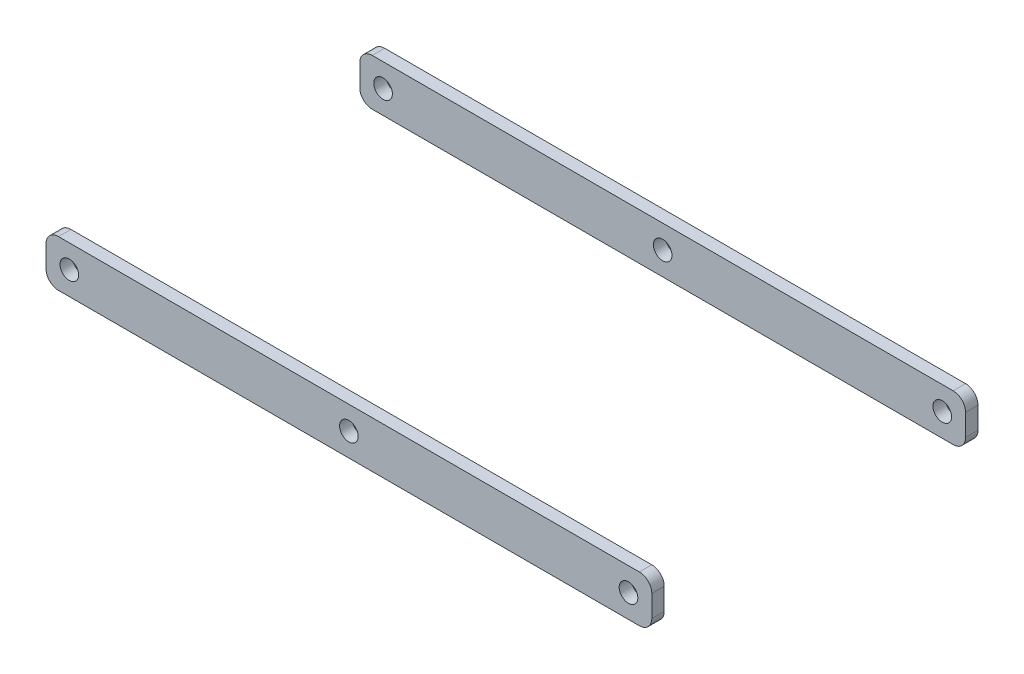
SolidWorks part; units mm, degrees
ref_plane "前视基准面" through (0, 0, 0) normal (0, 0, 1) x (1, 0, 0)
ref_plane "上视基准面" through (0, 0, 0) normal (0, 1, 0) x (1, 0, 0)
ref_plane "右视基准面" through (0, 0, 0) normal (1, 0, 0) x (0, 0, -1)
other "Configuration Table"
sketch "草图1" plane through (0, 0, 0) normal (0, 0, 1) x (1, 0, 0)
  line L1 (-195, -15) -> (195, -15)
  line L2 (-195, -15) -> (-195, 15)
  line L3 (-195, 15) -> (195, 15)
  line L4 (195, -15) -> (195, 15)
  line L5 (-195, -15) -> (195, 15) construction
  line L6 (-195, 15) -> (195, -15) construction
  point P0 (0, 0)
  dimension "D1" = 195
  dimension "D2" = 15
extrude "ArmBlank_390x30" add sketch "草图1" against normal mid plane 210
sketch "草图2" plane through (0, 0, 0) normal (0, 0, 1) x (1, 0, 0)
  line L1 (-200, -20) -> (200, -20)
  line L2 (-200, -20) -> (-200, 20)
  line L3 (-200, 20) -> (200, 20)
  line L4 (200, -20) -> (200, 20)
  line L5 (-200, -20) -> (200, 20) construction
  line L6 (-200, 20) -> (200, -20) construction
  point P0 (0, 0)
  dimension "D1" = 200
  dimension "D2" = 20
extrude "Separate_Left_Right_8mm_Arms" cut sketch "草图2" against normal mid plane 194
sketch "草图3" plane through (0, 0, 0) normal (0, 0, 1) x (1, 0, 0)
  circle A0 centre (-180, 0) radius 6
  circle A1 centre (0, 0) radius 6
  circle A2 centre (180, 0) radius 6
  dimension "D1" = 12
  dimension "D2" = 180
  dimension "D3" = 180
extrude "Three_Pivot_Holes_D12_Pitch180" cut sketch "草图3" against normal mid plane 1000
fillet "Arm_End_Corner_R8" radius 8 4 edges at (195, 15, -101) (195, -15, -101) (-195, -15, -101) (-195, 15, -101)
fillet "Arm_End_Corner_R8_Body1" radius 8 4 edges at (195, 15, 101) (-195, 15, 101) (-195, -15, 101) (195, -15, 101)
